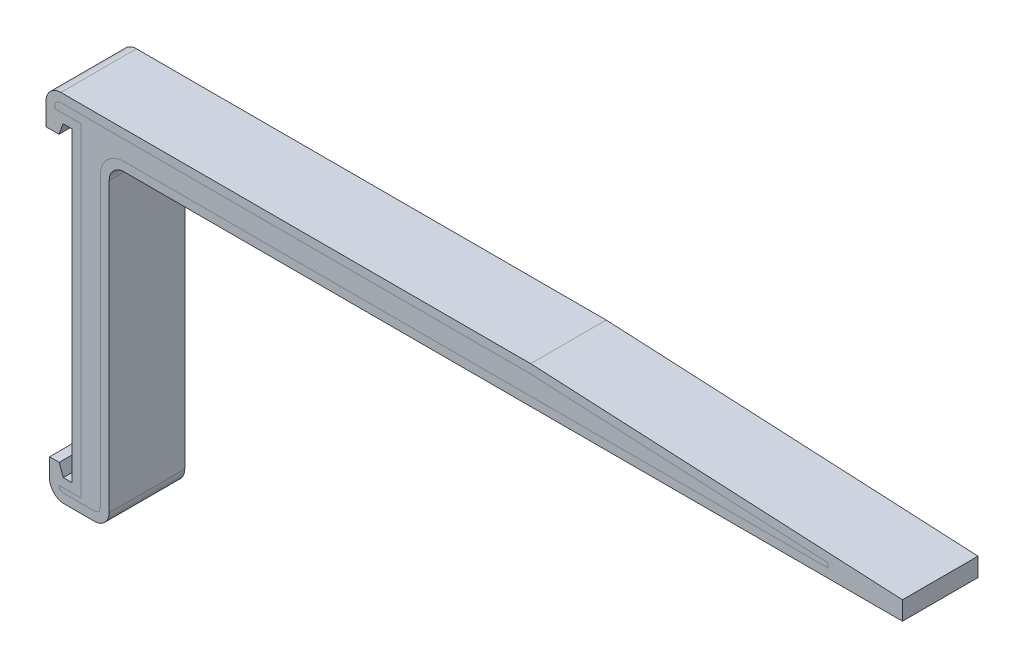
SolidWorks part; units mm, degrees
ref_plane "Front Plane" through (0, 0, 0) normal (0, 0, 1) x (1, 0, 0)
ref_plane "Top Plane" through (0, 0, 0) normal (0, 1, 0) x (1, 0, 0)
ref_plane "Right Plane" through (0, 0, 0) normal (1, 0, 0) x (0, 0, -1)
sketch "Sketch1" plane through (0, 0, 0) normal (0, 0, 1) x (1, 0, 0)
  line L2 (122.7596, -8459.375) -> (117.3, -8444.375)
  line L3 (117.3, -8444.375) -> (104.3, -8444.375)
  line L6 (122.7596, -8459.375) -> (116.5721, -8442.375) construction
  line L7 (134.55, -8459.375) -> (122.7596, -8459.375)
  line L8 (104.3, -8444.375) -> (104.3, -8489.375)
  line L9 (104.3, -8489.375) -> (184.55, -8489.375)
  line L10 (184.55, -8489.375) -> (184.55, -8062.375)
  line L11 (134.55, -8459.375) -> (134.55, -8047.375)
  line L19 (117.05, -8062.375) -> (99.55, -8062.375)
  line L20 (99.55, -8062.375) -> (99.55, -8012.375)
  line L21 (99.55, -8012.375) -> (751.35, -8012.375)
  line L25 (93.55, -8062.375) -> (117.05, -8062.375) construction
  line L26 (117.05, -8062.375) -> (122.5096, -8047.375)
  line L27 (122.5096, -8047.375) -> (134.55, -8047.375)
  line L28 (184.55, -8062.375) -> (1251.35, -8062.375)
  line L29 (1251.35, -8062.375) -> (1251.35, -8037.375)
  line L30 (1251.35, -8037.375) -> (751.35, -8012.375)
  point P12 (0, 0)
  dimension "D2" = 17.25
  dimension "D3" = 35
  dimension "D4" = 50
  dimension "D5" = 50
  dimension "D6" = 45
  dimension "D7" = 13
  dimension "D8" = 2
  dimension "D9" = 1066.8
  dimension "D10" = 50
  dimension "D11" = 25
  dimension "D12" = 500
  dimension "D13" = 20
  dimension "D14" = 15
  dimension "D15" = 382
  dimension "D16" = 17.5
  dimension "D17" = 15
  dimension "D18" = 20
extrude "Boss-Extrude1" add sketch "Sketch1" against normal mid plane 101.6
sketch "Sketch2" plane through (0, -8062.375, 0) normal (0, -1, 0) x (1, 0, 0)
  line L0 (184.55, 0) -> (794.15, 0) construction
  line L1 (184.55, -50.8) -> (184.55, 50.8) construction
  line L2 (794.15, -294.0121) -> (794.15, 294.0121)
  line L3 (489.35, -277.8363) -> (489.35, 277.8363)
  line L4 (1098.95, -330.976) -> (1098.95, 330.976)
  point P10 (794.15, 0)
  point P11 (489.35, 0)
  point P12 (1098.95, 0)
  dimension "D1" = 609.6
  dimension "D2" = 304.8
  dimension "D3" = 304.8
fillet "Fillet1" radius 20 4 edges at (99.55, -8012.375, 0) (104.3, -8489.375, 0) (184.55, -8489.375, 0) (184.55, -8062.375, 0)
sketch "Sketch3" plane through (0, 0, 0) normal (0, 0, 1) x (1, 0, 0)
  line L0 (122.7596, -8459.375) -> (117.3, -8444.375)
  line L1 (122.7596, -8459.375) -> (117.3, -8444.375) construction
  line L2 (134.55, -8459.375) -> (122.7596, -8459.375)
  line L3 (134.55, -8459.375) -> (122.7596, -8459.375)
  line L4 (134.55, -8047.375) -> (134.55, -8459.375)
  line L5 (134.55, -8047.375) -> (134.55, -8459.375) construction
  line L6 (134.55, -8459.375) -> (134.55, -8451.375)
  line L7 (134.55, -8451.375) -> (119.8478, -8451.375)
  line L8 (119.8478, -8451.375) -> (122.7596, -8459.375)
  dimension "D1" = 8
extrude "Boss-Extrude2" add sketch "Sketch3" along normal mid plane 13
sketch "Sketch4" plane through (134.55, 0, 0) normal (-1, 0, 0) x (0, 0, 1)
  line L0 (50.8, -8047.375) -> (50.8, -8459.375) construction
  line L1 (50.8, -8337.969) -> (-50.8, -8337.969)
  line L2 (50.8, -8337.969) -> (50.8, -8157.3406)
  line L3 (50.8, -8157.3406) -> (-50.8, -8157.3406)
  line L4 (-50.8, -8337.969) -> (-50.8, -8157.3406)
  line L5 (-50.8, -8047.375) -> (-50.8, -8459.375) construction
sketch "Sketch5" plane through (0, 0, 50.8) normal (0, 0, 1) x (1, 0, 0)
  line L20 (114.1071, -8035.375) -> (111.55, -8035.375)
  line L21 (111.55, -8035.375) -> (111.55, -8032.375)
  line L22 (1151.0502, -8050.375) -> (1151.0502, -8044.375)
  line L23 (1151.0502, -8044.375) -> (751.0502, -8024.375)
  line L24 (1098.95, -8050.375) -> (1151.0502, -8050.375)
  line L40 (751.0502, -8024.375) -> (119.55, -8024.375)
  line L41 (111.55, -8032.375) -> (111.55, -8042.4005)
  line L42 (111.55, -8042.4005) -> (114.1071, -8035.375)
  line L43 (114.1071, -8035.375) -> (146.55, -8035.375)
  line L44 (146.55, -8035.375) -> (146.55, -8157.3406)
  line L45 (146.55, -8157.3406) -> (146.55, -8337.969)
  line L46 (146.55, -8337.969) -> (146.55, -8471.375)
  line L47 (146.55, -8471.375) -> (116.554, -8471.375)
  line L49 (124.3, -8477.375) -> (164.55, -8477.375)
  line L50 (172.55, -8469.375) -> (172.55, -8082.375)
  line L51 (204.55, -8050.375) -> (489.35, -8050.375)
  line L52 (489.35, -8050.375) -> (794.15, -8050.375)
  line L53 (794.15, -8050.375) -> (1098.95, -8050.375)
  line L54 (1098.95, -8050.375) -> (1239.35, -8050.375)
  line L55 (1239.35, -8050.375) -> (1239.35, -8048.79)
  line L56 (1239.35, -8048.79) -> (751.0502, -8024.375)
  line L57 (751.0502, -8024.375) -> (119.55, -8024.375)
  line L58 (111.55, -8032.375) -> (111.55, -8042.4005) construction
  line L59 (111.55, -8042.4005) -> (114.1071, -8035.375) construction
  line L60 (114.1071, -8035.375) -> (146.55, -8035.375)
  line L61 (146.55, -8035.375) -> (146.55, -8157.3406)
  line L62 (146.55, -8157.3406) -> (146.55, -8337.969)
  line L63 (146.55, -8337.969) -> (146.55, -8471.375)
  line L64 (146.55, -8471.375) -> (116.554, -8471.375)
  line L66 (124.3, -8477.375) -> (164.55, -8477.375)
  line L67 (172.55, -8469.375) -> (172.55, -8082.375)
  line L68 (204.55, -8050.375) -> (489.35, -8050.375)
  line L69 (489.35, -8050.375) -> (794.15, -8050.375)
  line L70 (794.15, -8050.375) -> (1098.95, -8050.375)
  line L71 (1098.95, -8050.375) -> (1239.35, -8050.375) construction
  line L72 (1239.35, -8050.375) -> (1239.35, -8048.79) construction
  line L73 (1239.35, -8048.79) -> (751.0502, -8024.375) construction
  arc A8 (119.55, -8024.375) -> (111.55, -8032.375) centre (119.55, -8032.375) ccw
  arc A9 (116.554, -8471.375) -> (124.3, -8477.375) centre (124.3, -8469.375) ccw
  arc A10 (164.55, -8477.375) -> (172.55, -8469.375) centre (164.55, -8469.375) ccw
  arc A11 (204.55, -8050.375) -> (172.55, -8082.375) centre (204.55, -8082.375) ccw
  arc A12 (119.55, -8024.375) -> (111.55, -8032.375) centre (119.55, -8032.375) ccw
  arc A13 (116.554, -8471.375) -> (124.3, -8477.375) centre (124.3, -8469.375) ccw
  arc A14 (164.55, -8477.375) -> (172.55, -8469.375) centre (164.55, -8469.375) ccw
  arc A15 (204.55, -8050.375) -> (172.55, -8082.375) centre (204.55, -8082.375) ccw
  dimension "D2" = 6
  dimension "D1" = 12
